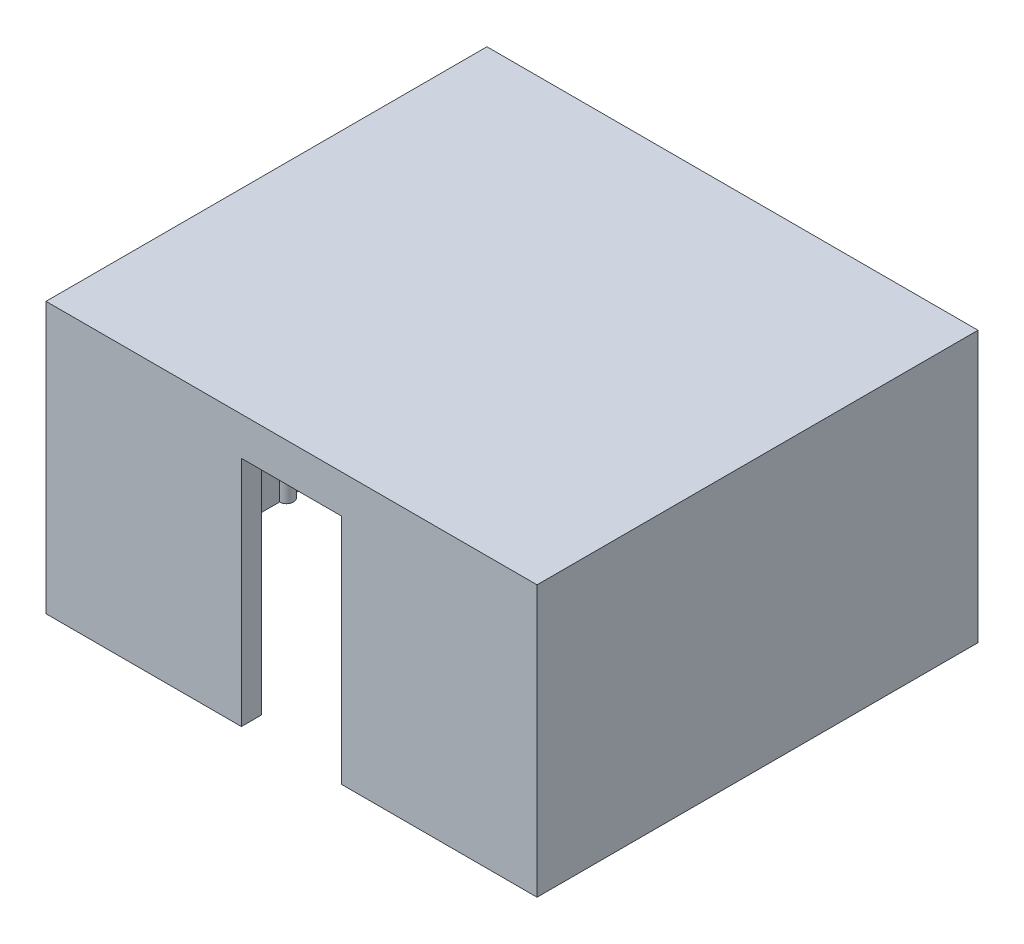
SolidWorks part; units mm, degrees
ref_plane "Front Plane" through (0, 0, 0) normal (0, 0, 1) x (1, 0, 0)
ref_plane "Top Plane" through (0, 0, 0) normal (0, 1, 0) x (1, 0, 0)
ref_plane "Right Plane" through (0, 0, 0) normal (1, 0, 0) x (0, 0, -1)
sketch "Sketch1" plane through (0, 0, 0) normal (0, 1, 0) x (1, 0, 0)
  line L1 (0, 0) -> (-49, 0)
  line L2 (0, 0) -> (0, 44)
  line L3 (0, 44) -> (-49, 44)
  line L4 (-49, 0) -> (-49, 44)
  dimension "D1" = 49
  dimension "D2" = 44
extrude "Boss-Extrude1" add sketch "Sketch1" along normal blind 27
shell "Shell1" thickness 2
sketch "Sketch2" plane through (0, 0, 0) normal (0, 0, 1) x (1, 0, 0)
  line L5 (-49, 0) -> (0, 0) construction
  line L6 (-29.5, 0) -> (-19.5, 0)
  line L7 (-29.5, 0) -> (-29.5, 23.1835)
  line L8 (-29.5, 23.1835) -> (-19.5, 23.1835)
  line L9 (-19.5, 0) -> (-19.5, 23.1835)
  line L10 (-49, 27) -> (0, 27) construction
  point P5 (-18.6105, 0)
  point P11 (-24.5, 27)
  dimension "D1" = 5
  dimension "D2" = 5
extrude "Cut-Extrude2" cut sketch "Sketch2" against normal blind 10
sketch "Sketch4" plane through (0, 25, 0) normal (0, -1, 0) x (1, 0, 0)
  line L0 (-47, -42) -> (-47, -2) construction
  line L1 (-2, -42) -> (-47, -42) construction
  line L2 (-19.5, -2) -> (-2, -2) construction
  line L3 (-47, -2) -> (-29.5, -2) construction
  line L4 (-2, -2) -> (-2, -42) construction
  circle A0 centre (-47, -22) radius 0.7
  circle A1 centre (-24.5, -42) radius 0.7
  circle A2 centre (-10.75, -2) radius 0.7
  circle A3 centre (-38.25, -2) radius 0.7
  circle A4 centre (-2, -22) radius 0.7
  dimension "D1" = 1.4
  dimension "D2" = 1.4
  dimension "D3" = 1.4
  dimension "D4" = 1.4
  dimension "D5" = 1.4
extrude "Boss-Extrude3" add sketch "Sketch4" along normal blind 25
